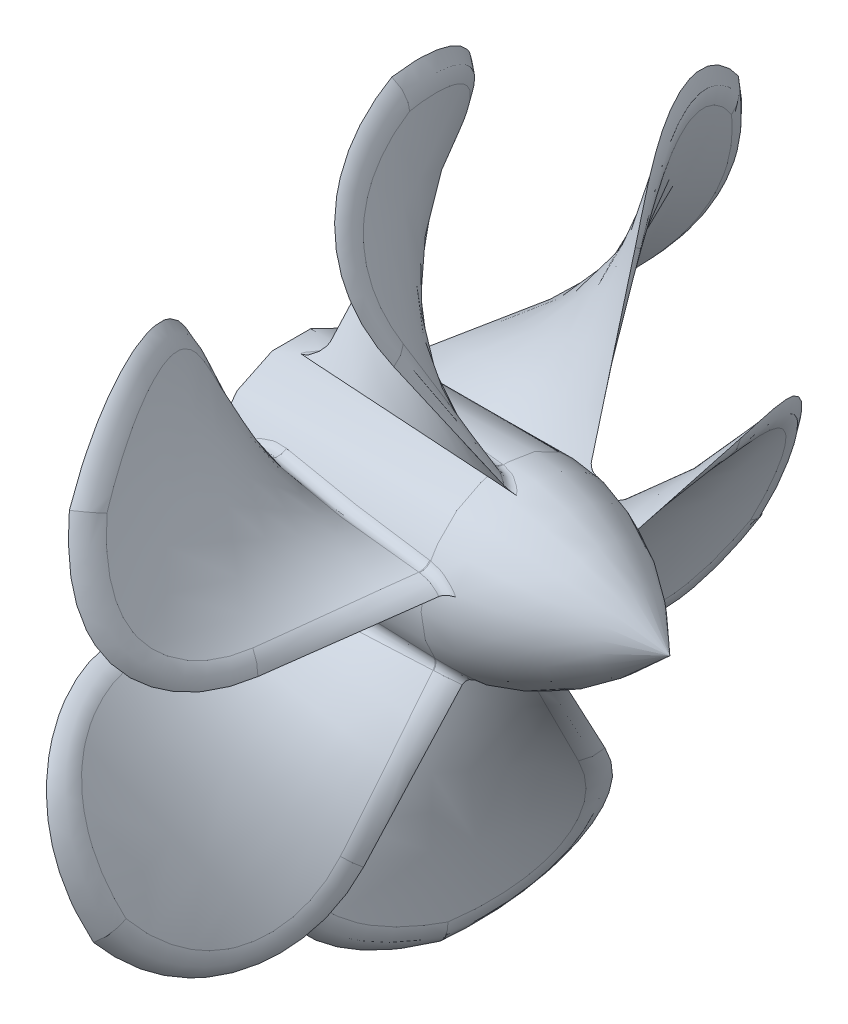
SolidWorks part; units mm, degrees
ref_plane "Front" through (0, 0, 0) normal (0, 0, 1) x (1, 0, 0)
ref_plane "Top" through (0, 0, 0) normal (0, 1, 0) x (1, 0, 0)
ref_plane "Right" through (0, 0, 0) normal (1, 0, 0) x (0, 0, -1)
sketch "Sketch1" plane through (0, 0, 0) normal (0, 0, 1) x (1, 0, 0)
  line L0 (-175, 0) -> (175, 0)
  line L1 (0, -35) -> (0, 66.6981) construction
  line L2 (-175, 0) -> (-175, 80)
  line L3 (-175, 80) -> (25, 80)
  line L4 (103.7978, 80) -> (-10.6964, 80) construction
  spline S0 degree 2 poles (25, 80) (96.5588, 80) (175, 0) knots 0 0 0 1 1 1
  dimension "D1" = 350
  dimension "D2" = 80
  dimension "D3" = 200
revolve "Revolve1" add sketch "Sketch1" angle 360 about L0
sketch "Sketch2" plane through (0, 0, 0) normal (0, 1, 0) x (1, 0, 0)
  line L0 (55, 40.9087) -> (-154.0836, -54.9246)
  line L1 (55, 40.9087) -> (60, 30)
  line L2 (-154.0836, -54.9246) -> (-149.0836, -65.8333)
  line L3 (60, 30) -> (-149.0836, -65.8333)
  line L4 (0, 0) -> (209.2898, 0) construction
  line L5 (-175, 80) -> (-175, -80) construction
  dimension "D1" = 12
  dimension "D2" = 230
  dimension "D3" = 230
  dimension "D4" = 30
  dimension "D5" = 60
ref_plane "Plane1" through (0, 360, 0) normal (0, 1, 0) x (1, 0, 0)
sketch "Sketch3" plane through (0, 360, 0) normal (0, 1, 0) x (1, 0, 0)
  line L0 (-113, 190) -> (-16.2312, -198.1183)
  line L1 (-113, 190) -> (-101.3565, 192.9031)
  line L2 (-16.2312, -198.1183) -> (-4.5877, -195.2152)
  line L3 (-101.3565, 192.9031) -> (-4.5877, -195.2152)
  line L4 (-175, 80) -> (-175, -80) construction
  point P8 (0, 0)
  dimension "D1" = 400
  dimension "D2" = 12
  dimension "D3" = 14
  dimension "D4" = 190
  dimension "D5" = 62
loft "Loft1" add profiles "Sketch2", "Sketch3"
sketch "Sketch4" plane through (-175, 0, 0) normal (-1, 0, 0) x (0, 0, 1)
  circle A0 centre (0, 0) radius 57
  dimension "D1" = 114
extrude "Cut-Extrude1" cut sketch "Sketch4" against normal blind 180
fillet "Fillet5" radius 135 2 edges
fillet "Fillet7" radius 30 4 edges at (-91.5388, 296.263, -99.3704) (-3.7387, 277.6326, 112.2328)
fillet "Fillet8" radius 10 4 edges at (-134.1138, 79.8953, 4.092) (35.082, 78.576, 12.762) (-58.6952, 79.8317, 5.1869)
pattern_circular "CirPattern1" count 6 over 360 about axis through (-175, 0, 0) along (-1, 0, 0) of "Loft1", "Fillet5", "Fillet7", "Fillet8"
